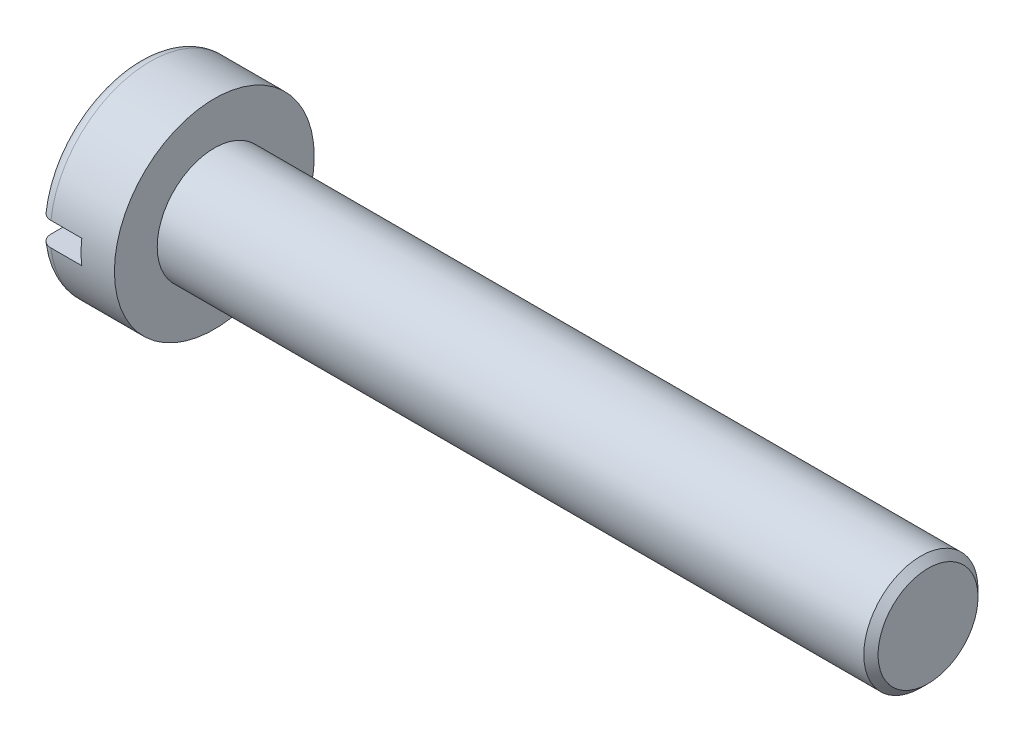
SolidWorks part; units mm, degrees
ref_plane "Face" through (0, 0, 0) normal (0, 0, 1) x (1, 0, 0)
ref_plane "Dessus" through (0, 0, 0) normal (0, 1, 0) x (1, 0, 0)
ref_plane "Droite" through (0, 0, 0) normal (1, 0, 0) x (0, 0, -1)
sketch "Esquisse1" plane through (0, 0, 0) normal (0, 0, 1) x (1, 0, 0)
  line L1 (0, 0) -> (3.2, 0)
  line L2 (0, 0) -> (0, 3.7)
  line L3 (0.5, 4.2) -> (3.2, 4.2)
  line L4 (3.2, 0) -> (3.2, 4.2)
  line L5 (0, 0) -> (7.6423, 0) construction
  arc A0 (0, 3.7) -> (0.5, 4.2) centre (0.5, 3.7) cw
  dimension "D1" = 0.5
revolve "Révolution1" add sketch "Esquisse1" angle 360 about L5
sketch "Esquisse2" plane through (0, 0, 0) normal (0, 0, 1) x (1, 0, 0)
  line L2 (0, -0.5) -> (1.8, -0.5)
  line L3 (0, -0.5) -> (0, 0.5)
  line L4 (0, 0.5) -> (1.8, 0.5)
  line L5 (1.8, -0.5) -> (1.8, 0.5)
  line L7 (1.8887, 0.5) -> (-1.9597, 0.5) construction
  line L8 (-1.4199, -0.5) -> (2.1644, -0.5) construction
  line L9 (1.8, -0.7734) -> (1.8, 0.9196) construction
  line L10 (0, 0.8493) -> (0, -0.9902) construction
extrude "Enlèv. mat.-Extru.1" cut sketch "Esquisse2" against normal mid plane 10
sketch "Esquisse3" plane through (3.2, 0, 0) normal (1, 0, 0) x (0, 0, -1)
  circle A0 centre (0, 0) radius 2.4
extrude "Extrusion1" add sketch "Esquisse3" along normal blind 30
chamfer "Chanfrein1" distance 0.3 angle 45 1 edges at (33.2, 0, -2.4)
